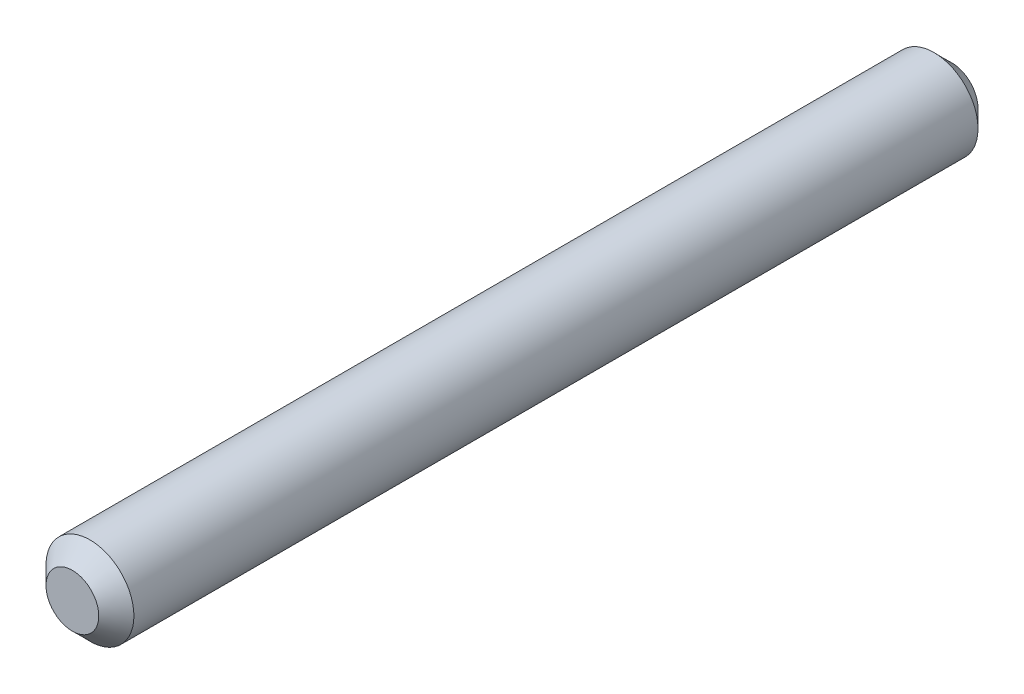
SolidWorks part; units mm, degrees
ref_plane "Plan1" through (0, 0, 0) normal (0, 0, 1) x (1, 0, 0)
ref_plane "Plan2" through (0, 0, 0) normal (0, 1, 0) x (1, 0, 0)
ref_plane "Plan3" through (0, 0, 0) normal (1, 0, 0) x (0, 0, -1)
sketch "Esquisse1" plane through (0, 0, 0) normal (0, 0, 1) x (1, 0, 0)
  circle A0 centre (0, 0) radius 1.25
  dimension "D1" = 2.5
extrude "Base-Extrusion" add sketch "Esquisse1" along normal blind 25
chamfer "Chanfrein1" distance 0.5 angle 45
